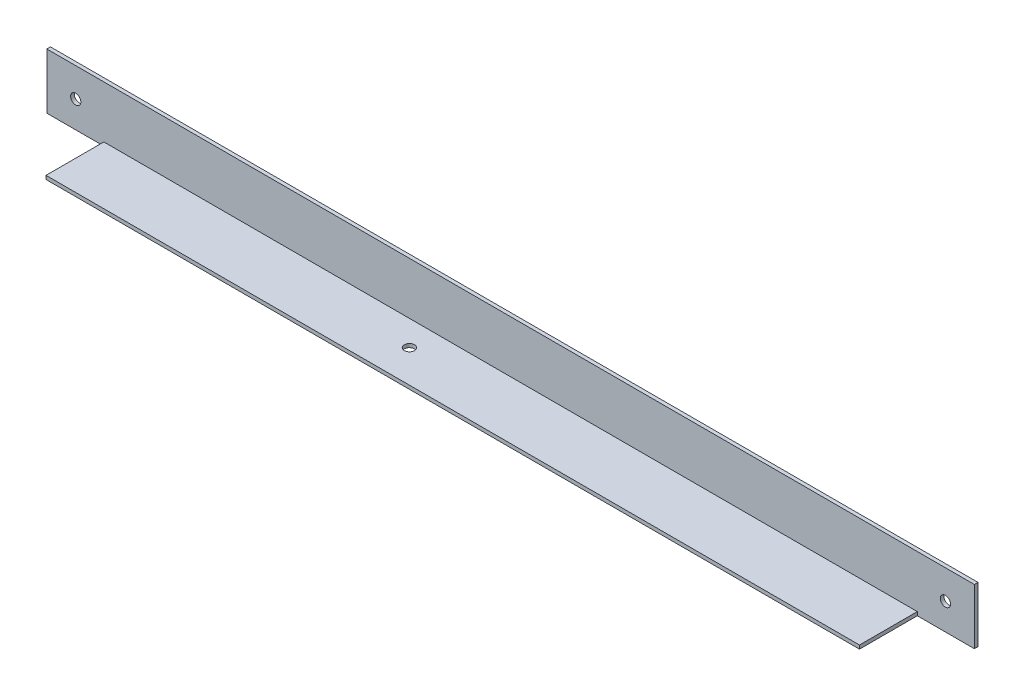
SolidWorks part; units mm, degrees
ref_plane "Front" through (0, 0, 0) normal (0, 0, 1) x (1, 0, 0)
ref_plane "Top" through (0, 0, 0) normal (0, 1, 0) x (1, 0, 0)
ref_plane "Right" through (0, 0, 0) normal (1, 0, 0) x (0, 0, -1)
sketch "Sketch1" plane through (0, 0, 0) normal (0, 0, 1) x (1, 0, 0)
  line L1 (-209.8261, 67.8385) -> (196.5739, 67.8385)
  line L2 (-209.8261, 67.8385) -> (-209.8261, 43.4545)
  line L3 (-209.8261, 43.4545) -> (196.5739, 43.4545)
  line L4 (196.5739, 67.8385) -> (196.5739, 43.4545)
  dimension "D1" = 406.4
  dimension "D2" = 24.384
extrude "Boss-Extrude1" add sketch "Sketch1" along normal blind 26.924
sketch "Sketch2" plane through (0, 67.8385, 0) normal (0, 1, 0) x (1, 0, 0)
  line L0 (-209.8261, -26.924) -> (-209.8261, 0) construction
  line L1 (-209.8261, -1.5875) -> (196.5739, -1.5875)
  line L2 (-209.8261, -1.5875) -> (-209.8261, -26.924)
  line L3 (-209.8261, -26.924) -> (196.5739, -26.924)
  line L4 (196.5739, -1.5875) -> (196.5739, -26.924)
  line L5 (196.5739, 0) -> (-209.8261, 0) construction
  dimension "D1" = 1.5875
extrude "Cut-Extrude1" cut sketch "Sketch2" against normal blind 12.7
sketch "Sketch3" plane through (0, 0, 26.924) normal (0, 0, 1) x (1, 0, 0)
  line L0 (196.5739, 43.4545) -> (196.5739, 55.1385) construction
  line L1 (-209.8261, 55.1385) -> (196.5739, 55.1385)
  line L2 (-209.8261, 55.1385) -> (-209.8261, 45.042)
  line L3 (-209.8261, 45.042) -> (196.5739, 45.042)
  line L4 (196.5739, 55.1385) -> (196.5739, 45.042)
  line L5 (-209.8261, 43.4545) -> (196.5739, 43.4545) construction
  dimension "D1" = 1.5875
extrude "Cut-Extrude3" cut sketch "Sketch3" against normal up to surface (25.3365 mm away)
sketch "Sketch4" plane through (0, 43.4545, 0) normal (0, -1, 0) x (1, 0, 0)
  line L0 (-209.8261, 0) -> (196.5739, 0) construction
  line L1 (-209.8261, 26.924) -> (-209.8261, 0) construction
  line L2 (-6.6261, 26.924) -> (-6.6261, -64.6227) construction
  line L3 (-209.8261, 26.924) -> (196.5739, 26.924) construction
  circle A0 centre (-197.1261, 12.7) radius 2.032
  circle A1 centre (183.8739, 12.7) radius 2.032
  dimension "D1" = 4.064
  dimension "D2" = 12.7
  dimension "D3" = 12.7
sketch "Sketch5" plane through (0, 0, 0) normal (0, 0, -1) x (-1, 0, 0)
  line L0 (6.6261, 77.4225) -> (6.6261, -19.794) construction
  line L1 (-196.5739, 67.8385) -> (209.8261, 67.8385) construction
  line L2 (-196.5739, 43.4545) -> (-196.5739, 67.8385) construction
  circle A0 centre (-183.8739, 55.1385) radius 2.235
  circle A1 centre (197.1261, 55.1385) radius 2.235
  dimension "D3" = 4.47
  dimension "D1" = 12.7
  dimension "D2" = 12.7
extrude "Cut-Extrude4" cut sketch "Sketch4" against normal blind 2.54
extrude "Cut-Extrude5" cut sketch "Sketch5" against normal blind 2.54
sketch "Sketch6" plane through (0, 45.042, 0) normal (0, 1, 0) x (1, 0, 0)
  line L0 (-209.8261, -26.924) -> (196.5739, -26.924) construction
  line L1 (-209.8261, -1.5875) -> (-184.8261, -1.5875)
  line L2 (-209.8261, -1.5875) -> (-209.8261, -26.924)
  line L3 (-209.8261, -26.924) -> (-184.8261, -26.924)
  line L4 (-184.8261, -1.5875) -> (-184.8261, -26.924)
  line L5 (-209.8261, -1.5875) -> (196.5739, -1.5875) construction
  line L6 (196.5739, -26.924) -> (171.5739, -26.924)
  line L7 (196.5739, -26.924) -> (196.5739, -1.5875)
  line L8 (196.5739, -1.5875) -> (171.5739, -1.5875)
  line L9 (171.5739, -26.924) -> (171.5739, -1.5875)
  dimension "D1" = 25
  dimension "D2" = 25
extrude "Cut-Extrude6" cut sketch "Sketch6" against normal blind 2.54
sketch "Sketch7" plane through (0, 43.4545, 0) normal (0, -1, 0) x (1, 0, 0)
  circle A0 centre (-39.8261, 12.7) radius 2.2339
  dimension "D1" = 170
extrude "Cut-Extrude7" cut sketch "Sketch7" against normal blind 10
equation "\".5n\"=1"
